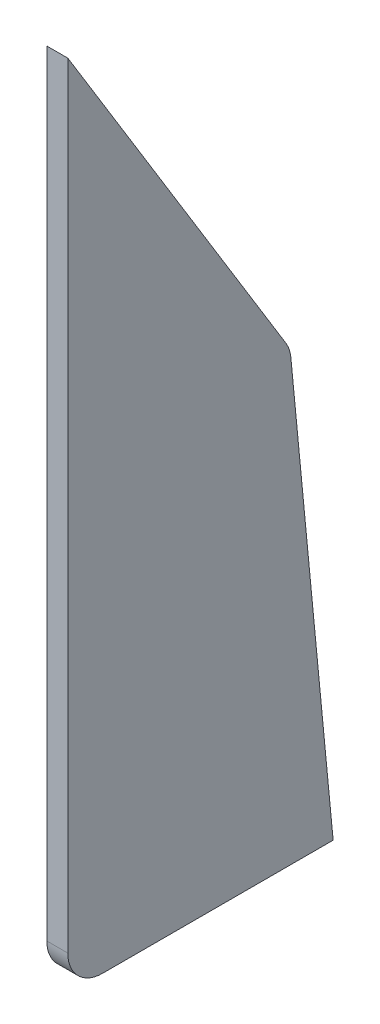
SolidWorks part; units mm, degrees
ref_plane "Plan de face" through (0, 0, 0) normal (0, 0, 1) x (1, 0, 0)
ref_plane "Plan de dessus" through (0, 0, 0) normal (0, 1, 0) x (1, 0, 0)
ref_plane "Plan de droite" through (0, 0, 0) normal (1, 0, 0) x (0, 0, -1)
sketch "Esquisse1" plane through (0, 0, 0) normal (1, 0, 0) x (0, 0, -1)
  line L0 (0, 0) -> (31.2291, -50.9613)
  line L1 (31.9429, -53.0945) -> (38, -116)
  line L2 (38, -116) -> (5, -116)
  line L3 (0, -111) -> (0, 0)
  arc A0 (5, -116) -> (0, -111) centre (5, -111) cw
  arc A1 (31.2291, -50.9613) -> (31.9429, -53.0945) centre (26.9659, -53.5738) cw
  dimension "D2" = 5
  dimension "D6" = 5
  dimension "D1" = 111
  dimension "D3" = 33
  dimension "D4" = 31.5
  dimension "D5" = 84.5
extrude "Extrusion1" add sketch "Esquisse1" along normal blind 3
